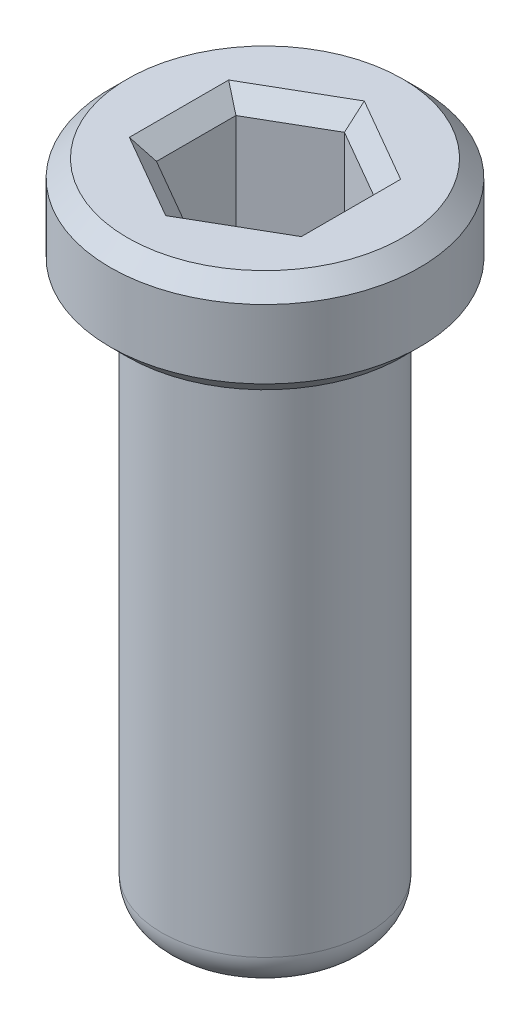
SolidWorks part; units mm, degrees
ref_plane "Front Plane" through (0, 0, 0) normal (0, 0, 1) x (1, 0, 0)
ref_plane "Top Plane" through (0, 0, 0) normal (0, 1, 0) x (1, 0, 0)
ref_plane "Right Plane" through (0, 0, 0) normal (1, 0, 0) x (0, 0, -1)
sketch "Sketch1" plane through (0, 0, 0) normal (0, 1, 0) x (1, 0, 0)
  circle A0 centre (0, 0) radius 1.5
  dimension "D1" = 3
extrude "Boss-Extrude1" add sketch "Sketch1" along normal blind 8
sketch "Sketch2" plane through (0, 8, 0) normal (0, 1, 0) x (1, 0, 0)
  circle A0 centre (0, 0) radius 2.25
  dimension "D1" = 4.5
extrude "Boss-Extrude2" add sketch "Sketch2" along normal blind 1.5
sketch "Sketch3" plane through (0, 9.5, 0) normal (0, 1, 0) x (1, 0, 0)
  line L1 (0, 1.1547) -> (-1, 0.5774)
  line L2 (-1, 0.5774) -> (-1, -0.5774)
  line L3 (-1, -0.5774) -> (0, -1.1547)
  line L4 (0, -1.1547) -> (1, -0.5774)
  line L5 (1, -0.5774) -> (1, 0.5774)
  line L6 (1, 0.5774) -> (0, 1.1547)
  circle A0 centre (0, 0) radius 1 construction
extrude "Cut-Extrude1" cut sketch "Sketch3" against normal blind 2
chamfer "Chamfer1" distance 0.25 angle 45 8 edges at (0, 8, 2.25) (0, 9.5, 2.25) (-0.5, 9.5, 0.866) (-1, 9.5, 0) (-0.5, 9.5, -0.866) (0.5, 9.5, -0.866) (1, 9.5, 0) (0.5, 9.5, 0.866)
fillet "Fillet1" radius 0.5 1 edges at (0, 0, 1.5)
